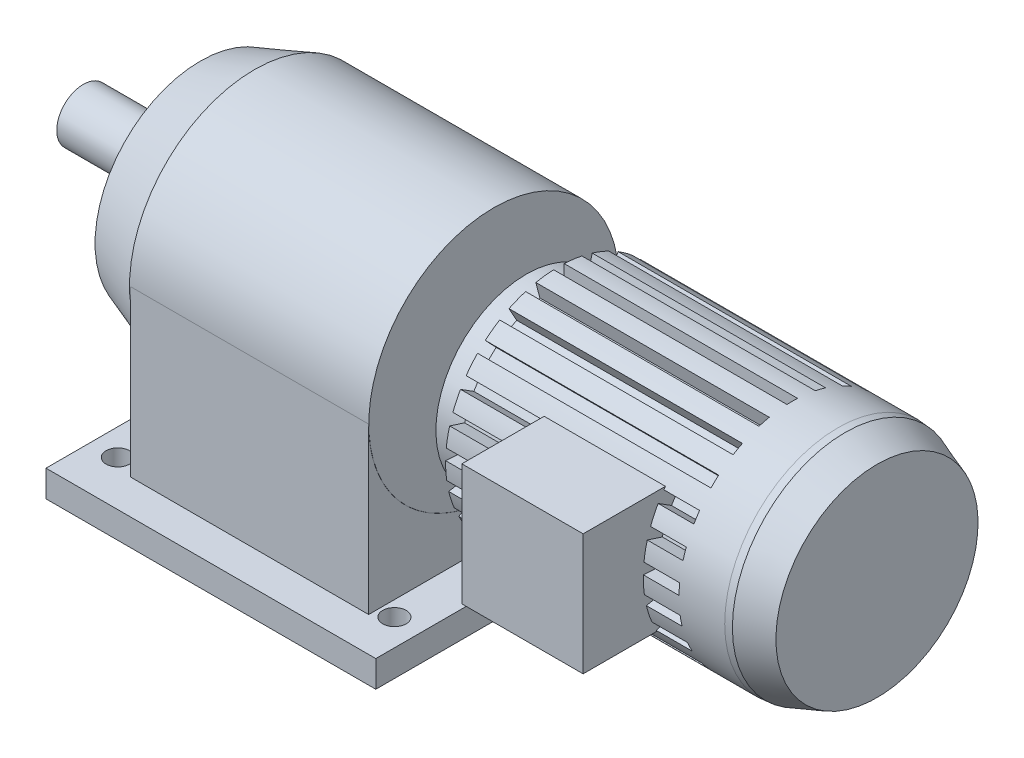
SolidWorks part; units mm, degrees
ref_plane "Front Plane" through (0, 0, 0) normal (0, 0, 1) x (1, 0, 0)
ref_plane "Top Plane" through (0, 0, 0) normal (0, 1, 0) x (1, 0, 0)
ref_plane "Right Plane" through (0, 0, 0) normal (1, 0, 0) x (0, 0, -1)
sketch "Sketch1" plane through (0, 0, 0) normal (0, 0, 1) x (1, 0, 0)
  line L0 (-385.8, 0) -> (-385.8, 25)
  line L1 (-385.8, 25) -> (-285.8, 25)
  line L2 (-280.8, 35) -> (-280.8, 60)
  line L3 (-280.8, 60) -> (-275.8, 60)
  line L4 (-275.8, 60) -> (-275.8, 98.9739)
  line L5 (-275.8, 98.9739) -> (-224.9, 117.5)
  line L6 (-224.9, 117.5) -> (0, 117.5)
  line L7 (0, 117.5) -> (0, 0)
  line L8 (-280.8, 35) -> (-285.8, 35)
  line L9 (-285.8, 35) -> (-285.8, 25)
  line L13 (0, 0) -> (-385.8, 0)
  dimension "D1" = 280.8
  dimension "D2" = 25
  dimension "D3" = 5
  dimension "D4" = 5
  dimension "D5" = 50.9
  dimension "D6" = 117.5
  dimension "D7" = 60
  dimension "D8" = 160
  dimension "D9" = 100
  dimension "D10" = 10
revolve "Revolve1" add sketch "Sketch1" angle 360 about L13
sketch "Sketch2" plane through (0, 0, 0) normal (0, 0, 1) x (1, 0, 0)
  line L0 (0, -6.3) -> (0, 33.7)
  line L1 (0, -117.5) -> (0, 117.5) construction
  line L2 (0, 33.7) -> (30.6, 33.7)
  line L3 (30.6, 33.7) -> (30.6, 78.7)
  line L4 (61.2, 100.2) -> (323.5604, 100.2)
  line L5 (330.2, 99.6191) -> (360.2, 88.7)
  line L6 (360.2, 88.7) -> (360.2, -6.3)
  line L7 (360.2, -6.3) -> (0, -6.3)
  line L8 (-385.8, 0) -> (0, 0) construction
  line L9 (-385.8, 25) -> (-385.8, -25) construction
  line L10 (323.5604, 100.2) -> (330.2, 99.6191)
  line L11 (30.6, 78.7) -> (61.2, 78.7)
  line L12 (61.2, 78.7) -> (61.2, 100.2)
  dimension "D1" = 12.6
  dimension "D2" = 360.2
  dimension "D3" = 106.5
  dimension "D4" = 40
  dimension "D5" = 30.6
  dimension "D6" = 30
  dimension "D7" = 20
  dimension "D8" = 5
  dimension "D9" = 95
  dimension "D10" = 30.6
  dimension "D11" = 85
revolve "Revolve2" add sketch "Sketch2" angle 360 about L7
sketch "Sketch4" plane through (0, 0, 0) normal (0, 0, 1) x (1, 0, 0)
  line L0 (323.5604, 100.2) -> (61.2, 100.2) construction
  line L1 (30.6, 100.2) -> (280.6, 100.2)
  line L2 (30.6, 100.2) -> (30.6, 85.2)
  line L3 (30.6, 85.2) -> (280.6, 85.2)
  line L4 (280.6, 100.2) -> (280.6, 85.2)
  line L5 (30.6, 100.2) -> (30.6, -112.8) construction
  dimension "D1" = 250
  dimension "D2" = 15
extrude "Cut-Extrude1" cut sketch "Sketch4" against normal mid plane 10
pattern_circular "CirPattern1" count 25 over 360 about axis through (0, -6.3, 0) along (1, 0, 0) of "Cut-Extrude1"
sketch "Sketch5" plane through (0, 0, 0) normal (0, 0, 1) x (1, 0, 0)
  line L0 (-275.8, 98.9739) -> (-275.8, -98.9739) construction
  line L1 (-270.9, -180) -> (39.1, -180)
  line L2 (-270.9, -180) -> (-270.9, -155)
  line L3 (-270.9, -155) -> (39.1, -155)
  line L4 (39.1, -180) -> (39.1, -155)
  dimension "D1" = 310
  dimension "D2" = 180
  dimension "D3" = 25
  dimension "D4" = 4.9
extrude "Boss-Extrude1" add sketch "Sketch5" along normal mid plane 300 contours L3 L4 L1 L2
ref_plane "Plane1" through (-224, 0, 0) normal (-1, 0, 0) x (0, 0, 1)
sketch "Sketch6" plane through (-224, 0, 0) normal (-1, 0, 0) x (0, 0, 1)
  line L0 (150, -155) -> (-150, -155) construction
  line L1 (-117.5, -155) -> (117.5, -155)
  line L2 (-117.5, -155) -> (-117.5, 0)
  line L3 (-117.5, 0) -> (117.5, 0)
  line L4 (117.5, -155) -> (117.5, 0)
  circle A0 centre (0, 0) radius 117.5 construction
extrude "Boss-Extrude2" add sketch "Sketch6" against normal blind 223.9
sketch "Sketch7" plane through (0, 0, 0) normal (0, 0, 1) x (1, 0, 0)
  line L0 (190, 0) -> (0, 0) construction
  line L1 (133, -57) -> (247, -57)
  line L2 (133, -57) -> (133, 57)
  line L3 (133, 57) -> (247, 57)
  line L4 (247, -57) -> (247, 57)
  line L5 (133, -57) -> (247, 57) construction
  line L6 (133, 57) -> (247, -57) construction
  point P0 (190, 0)
  dimension "D1" = 114
  dimension "D2" = 114
  dimension "D3" = 190
extrude "Boss-Extrude3" add sketch "Sketch7" along normal blind 163
sketch "Sketch8" plane through (0, -155, 0) normal (0, 1, 0) x (1, 0, 0)
  line L0 (-245.9, -107.5) -> (14.1, -107.5) construction
  line L5 (-270.9, -150) -> (39.1, -150) construction
  line L6 (-115.9, -107.5) -> (-115.9, -150) construction
  circle A0 centre (-245.9, -107.5) radius 11
  circle A1 centre (14.1, -107.5) radius 11
  dimension "D1" = 260
  dimension "D3" = 22
  dimension "D2" = 42.5
extrude "Cut-Extrude2" cut sketch "Sketch8" against normal through all
mirror "Mirror1" about plane through (0, 0, 0) normal (0, 0, 1) of "Cut-Extrude2"
